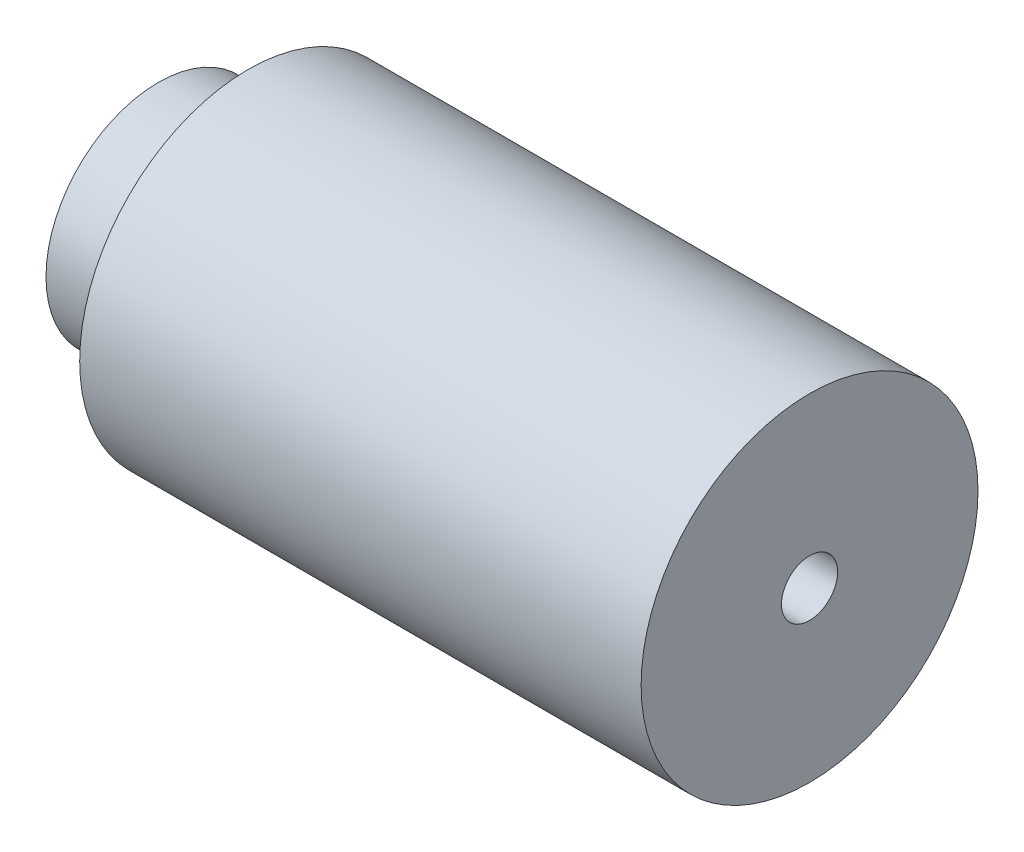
SolidWorks part; units mm, degrees
ref_plane "Front Plane" through (0, 0, 0) normal (0, 0, 1) x (1, 0, 0)
ref_plane "Top Plane" through (0, 0, 0) normal (0, 1, 0) x (1, 0, 0)
ref_plane "Right Plane" through (0, 0, 0) normal (1, 0, 0) x (0, 0, -1)
sketch "Sketch1" plane through (0, 0, 0) normal (1, 0, 0) x (0, 0, -1)
  circle A0 centre (0, 0) radius 15
  dimension "D1" = 30
extrude "Boss-Extrude1" add sketch "Sketch1" along normal blind 50
sketch "Sketch2" plane through (0, 0, 0) normal (-1, 0, 0) x (0, 0, 1)
  circle A0 centre (0, 0) radius 10
  dimension "D1" = 20
extrude "Boss-Extrude2" add sketch "Sketch2" along normal blind 8
sketch "Sketch4" plane through (-8, 0, 0) normal (-1, 0, 0) x (0, 0, 1)
  circle A0 centre (0, 0) radius 6
  dimension "D1" = 12
extrude "Cut-Extrude3" cut sketch "Sketch4" against normal blind 35
sketch "Sketch5" plane through (27, 0, 0) normal (-1, 0, 0) x (0, 0, 1)
  circle A0 centre (0, 0) radius 2.5
  dimension "D1" = 5
extrude "Cut-Extrude4" cut sketch "Sketch5" against normal blind 35
chamfer "Chamfer2" distance 5 angle 45 1 edges at (27, 0, 2.5)
